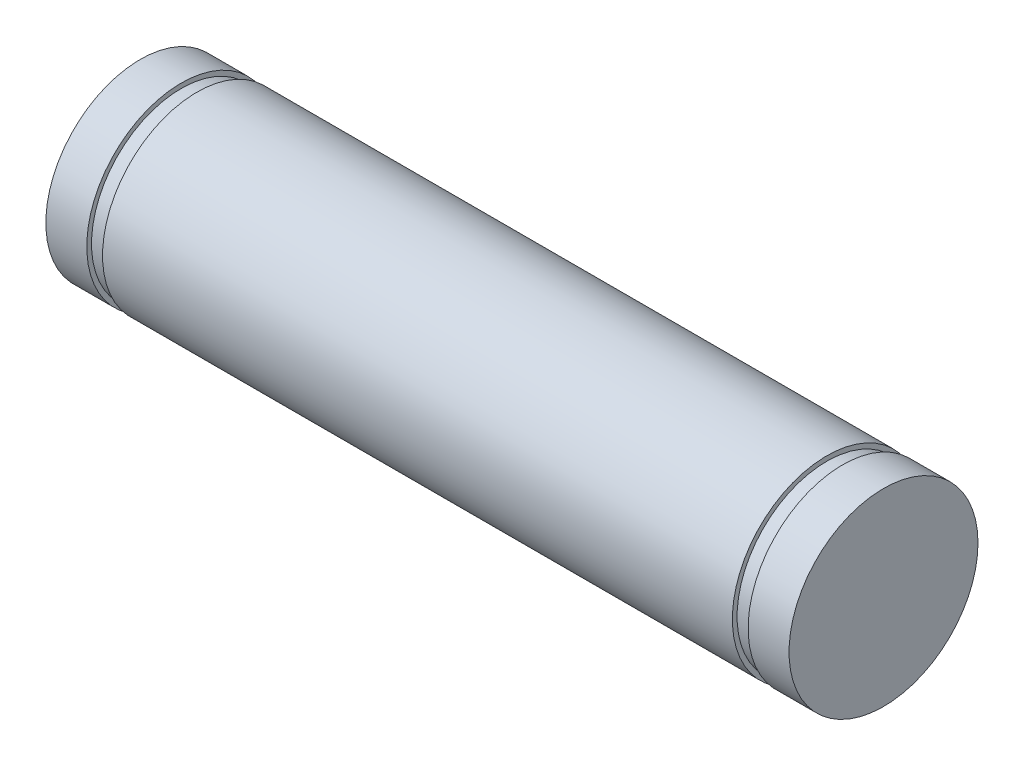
SolidWorks part; units mm, degrees
ref_plane "Front Plane" through (0, 0, 0) normal (0, 0, 1) x (1, 0, 0)
ref_plane "Top Plane" through (0, 0, 0) normal (0, 1, 0) x (1, 0, 0)
ref_plane "Right Plane" through (0, 0, 0) normal (1, 0, 0) x (0, 0, -1)
sketch "Sketch1" plane through (0, 0, 0) normal (0, 1, 0) x (1, 0, 0)
  line L0 (-213.5616, 0) -> (10464.5193, 0) construction
  line L1 (0, -213.5616) -> (0, 10464.5193) construction
  line L2 (11.8, 0) -> (-11.8, 0)
  line L3 (-11.8, 0) -> (-11.8, 3)
  line L4 (-11.8, 3) -> (-10.5, 3)
  line L5 (-10.5, 3) -> (-10.5, 2.85)
  line L6 (-10.5, 2.85) -> (-10, 2.85)
  line L7 (-10, 2.85) -> (-10, 3)
  line L8 (-10, 3) -> (10, 3)
  line L9 (10, 2.85) -> (10, 3)
  line L10 (10.5, 2.85) -> (10, 2.85)
  line L11 (10.5, 3) -> (10.5, 2.85)
  line L12 (11.8, 3) -> (10.5, 3)
  line L13 (11.8, 0) -> (11.8, 3)
  point P14 (0, 3)
  point P19 (0, 0)
  dimension "D1" = 3
  dimension "D2" = 2.85
  dimension "D3" = 20
  dimension "D4" = 0.5
  dimension "D5" = 1.3
revolve "Revolve1" add sketch "Sketch1" angle 360 about L2
